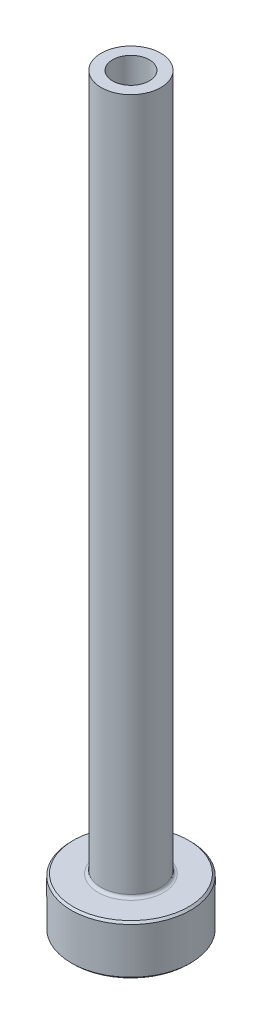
SolidWorks part; units mm, degrees
ref_plane "Front Plane" through (0, 0, 0) normal (0, 0, 1) x (1, 0, 0)
ref_plane "Top Plane" through (0, 0, 0) normal (0, 1, 0) x (1, 0, 0)
ref_plane "Right Plane" through (0, 0, 0) normal (1, 0, 0) x (0, 0, -1)
sketch "Sketch1" plane through (0, 0, 0) normal (0, 0, 1) x (1, 0, 0)
  line L0 (-1.85, 75) -> (-3, 75)
  line L1 (-3, 75) -> (-3, 5)
  line L2 (-3, 5) -> (-6, 5)
  line L3 (-6, 5) -> (-6, 0)
  line L4 (6.6, 0) -> (-6.6, 0) construction
  line L5 (-6, 0) -> (-2.1, 0)
  line L6 (-1.85, 30) -> (-1.85, 75)
  line L7 (0, 92.1877) -> (0, -15.5353) construction
  line L8 (0, -6.6) -> (0, 6.6) construction
  line L9 (-1.85, 30) -> (-2.1, 18)
  line L10 (-2.1, 18) -> (-2.1, 0)
  dimension "D1" = 0.25
  dimension "ID" = 3.7
  dimension "OD" = 6
  dimension "L" = 75
  dimension "H" = 12
  dimension "T" = 5
  dimension "N" = 45
  dimension "D2" = 12
revolve "Revolve1" add sketch "Sketch1" angle 360 about L7
fillet "Fillet1" radius 0.3 1 edges at (0, 5, 3)
chamfer "Chamfer1" distance 0.2 angle 45 2 edges at (0, 5, 6) (0, 0, 6)
chamfer "Chamfer3" distance 0.5 angle 45 1 edges at (0, 0, 2.1)
